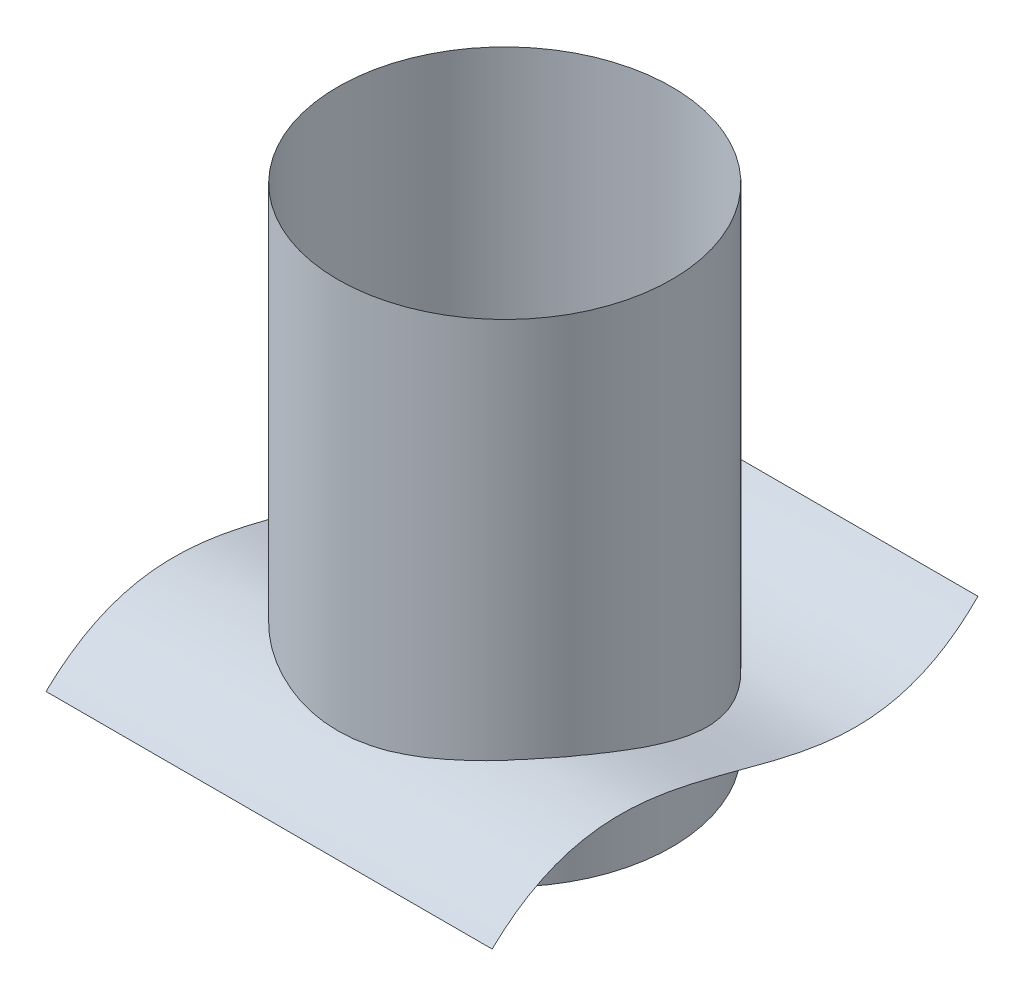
SolidWorks part; units mm, degrees
ref_plane "Front Plane" through (0, 0, 0) normal (0, 0, 1) x (1, 0, 0)
ref_plane "Top Plane" through (0, 0, 0) normal (0, 1, 0) x (1, 0, 0)
ref_plane "Right Plane" through (0, 0, 0) normal (1, 0, 0) x (0, 0, -1)
sketch "Sketch1" plane through (0, 0, 0) normal (0, 1, 0) x (1, 0, 0)
  circle A0 centre (0, 0) radius 44.1598
surface "Surface-Extrude1" sketch "Sketch1" parameters "D1"=130
sketch "Sketch2" plane through (0, 0, 0) normal (1, 0, 0) x (0, 0, -1)
  spline S0 degree 3 poles (-62.3438, -49.7478) (-20.4471, -9.761) (26.5163, -73.0135) (66.1607, -33.2076) knots 0 0 0 0 1 1 1 1
surface "Surface-Extrude2" sketch "Sketch2" parameters "D1"=118
ref_plane "Plane1" through (70, 0, 0) normal (1, 0, 0) x (0, 0, -1)
sketch "Sketch3" plane through (70, 0, 0) normal (1, 0, 0) x (0, 0, -1)
  line L0 (-49.4085, 36.6411) -> (49.1434, 36.6411)
  point P2 (0, 0)
sketch "Sketch4" plane through (0, 0, 0) normal (0, 0, 1) x (1, 0, 0)
  spline S0 degree 3 poles (7.1134, 12.0657) (-6.7575, 13.1353) (-31.0857, 10.2972) (-9.9628, -16.8864) (15.9991, -19.1919) (22.2401, 2.1604) (7.1134, 12.0657) (-6.7575, 13.1353) (-31.0857, 10.2972) knots -0.408977 -0.292331 -0.149138 0 0.132642 0.35943 0.591023 0.707669 0.850862 1 1.132642 1.35943 1.591023 only from (-8.4955, 12.5377) to (-8.4955, 12.5377)
  point P2 (-22.4911, 8.8444)
  point P4 (-6.7461, 17.5916)
  point P6 (6.2775, 17.0085)
  point P8 (20.2731, 6.5118)
  point P10 (18.1349, -7.2893)
  point P11 (-6.9405, -7.4837)
  point P12 (-7.718, 12.3433)
  point P13 (7.6382, 10.3995)
  point P14 (16.191, -12.3433)
  point P15 (-9.0787, -11.9545)
  point P16 (19.3012, 0)
  point P17 (-8.4955, 12.5377)
  point P18 (0, 0)
  point P19 (0, 0)
